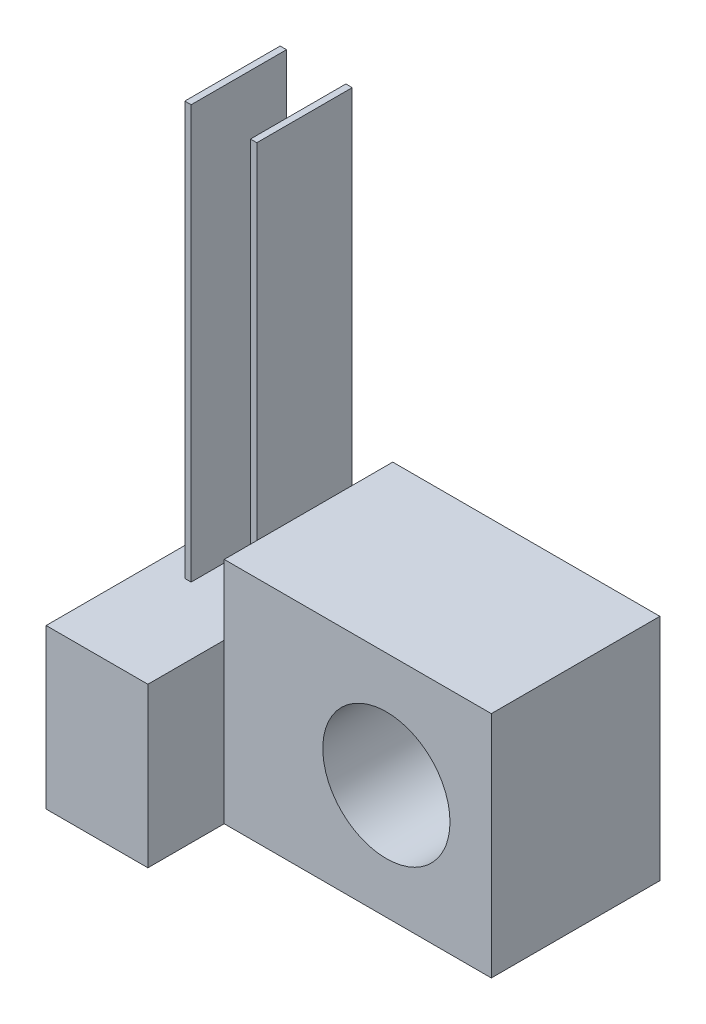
SolidWorks part; units mm, degrees
ref_plane "Plan de face" through (0, 0, 0) normal (0, 0, 1) x (1, 0, 0)
ref_plane "Plan de dessus" through (0, 0, 0) normal (0, 1, 0) x (1, 0, 0)
ref_plane "Plan de droite" through (0, 0, 0) normal (1, 0, 0) x (0, 0, -1)
ref_plane "Plan4" through (0, 0, 2.65) normal (0, 0, 1) x (1, 0, 0)
sketch "Esquisse2" plane through (0, 0, 2.65) normal (0, 0, 1) x (1, 0, 0)
  line L0 (12.1, 55.9996) -> (14.2732, 55.9996) construction
  line L1 (13.75, 57.7996) -> (9.55, 57.7996)
  line L2 (13.75, 57.7996) -> (13.75, 54.1996)
  line L3 (13.75, 54.1996) -> (7.95, 54.1996)
  line L4 (7.95, 56.6996) -> (7.95, 54.1996)
  line L5 (9.55, 57.7996) -> (9.55, 56.6996)
  line L6 (9.55, 56.6996) -> (7.95, 56.6996)
  circle A0 centre (12.1, 55.9996) radius 1 construction
  circle A1 centre (12.1, 55.9996) radius 1
  point P6 (13.75, 55.9996)
  dimension "D2" = 0.65
  dimension "D1" = 3.6
  dimension "D3" = 4.2
  dimension "D4" = 2.5
  dimension "D5" = 5.8
extrude "Extrusion1" add sketch "Esquisse2" against normal up to body
sketch "Esquisse3" plane through (0, 0, 2.65) normal (0, 0, 1) x (1, 0, 0)
  line L1 (9.55, 56.6996) -> (7.95, 56.6996)
  line L2 (9.55, 56.6996) -> (9.55, 54.1996)
  line L3 (9.55, 54.1996) -> (7.95, 54.1996)
  line L4 (7.95, 56.6996) -> (7.95, 54.1996)
extrude "Extrusion2" add sketch "Esquisse3" along normal blind 1.2
sketch "Esquisse4" plane through (0, 56.6996, 0) normal (0, 1, 0) x (-1, 0, 0)
  line L1 (-9.5323, 0.6194) -> (-9.4323, 0.6194)
  line L2 (-9.5323, 0.6194) -> (-9.5323, 2.1194)
  line L3 (-9.5323, 2.1194) -> (-9.4323, 2.1194)
  line L4 (-9.4323, 0.6194) -> (-9.4323, 2.1194)
  line L6 (-8.4991, 0.6194) -> (-8.3991, 0.6194)
  line L7 (-8.4991, 0.6194) -> (-8.4991, 2.1194)
  line L8 (-8.4991, 2.1194) -> (-8.3991, 2.1194)
  line L9 (-8.3991, 0.6194) -> (-8.3991, 2.1194)
  line L10 (-7.95, 1.3694) -> (-10.1507, 1.3694) construction
  dimension "D1" = 1.5
  dimension "D2" = 1.5
  dimension "D3" = 0.1
  dimension "D4" = 0.1
extrude "Extrusion3" add sketch "Esquisse4" along normal blind 6.5
sketch "Esquisse5" plane through (0, 54.1996, 0) normal (0, -1, 0) x (1, 0, 0)
  circle A0 centre (10.1742, 1.7809) radius 0.7
  circle A1 centre (8.6773, 1.7809) radius 0.7
  dimension "D1" = 1.4
